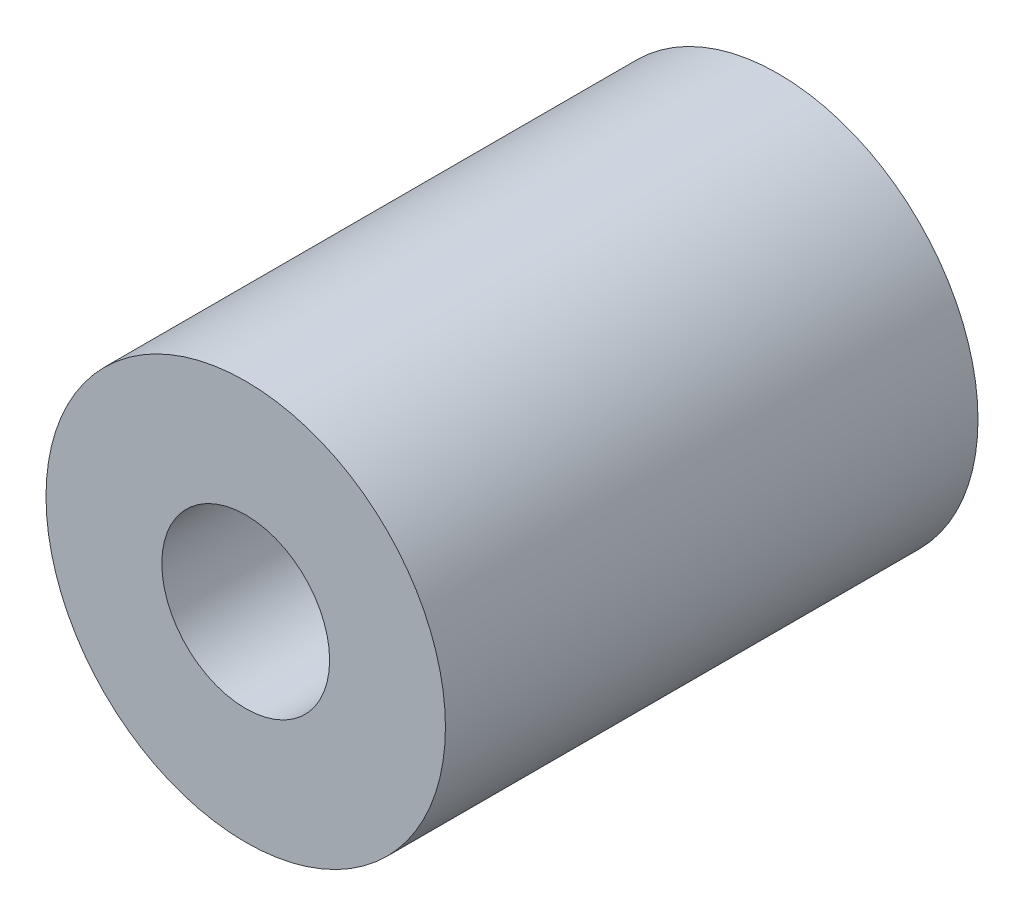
SolidWorks part; units mm, degrees
ref_plane "Front Plane" through (0, 0, 0) normal (0, 0, 1) x (1, 0, 0)
ref_plane "Top Plane" through (0, 0, 0) normal (0, 1, 0) x (1, 0, 0)
ref_plane "Right Plane" through (0, 0, 0) normal (1, 0, 0) x (0, 0, -1)
sketch "Sketch1" plane through (0, 0, 0) normal (0, 0, 1) x (1, 0, 0)
  circle A0 centre (0, 0) radius 4.0005
  circle A1 centre (0, 0) radius 9.525
  dimension "D1" = 8.001
  dimension "D2" = 19.05
extrude "Boss-Extrude1" add sketch "Sketch1" along normal blind 25.4
